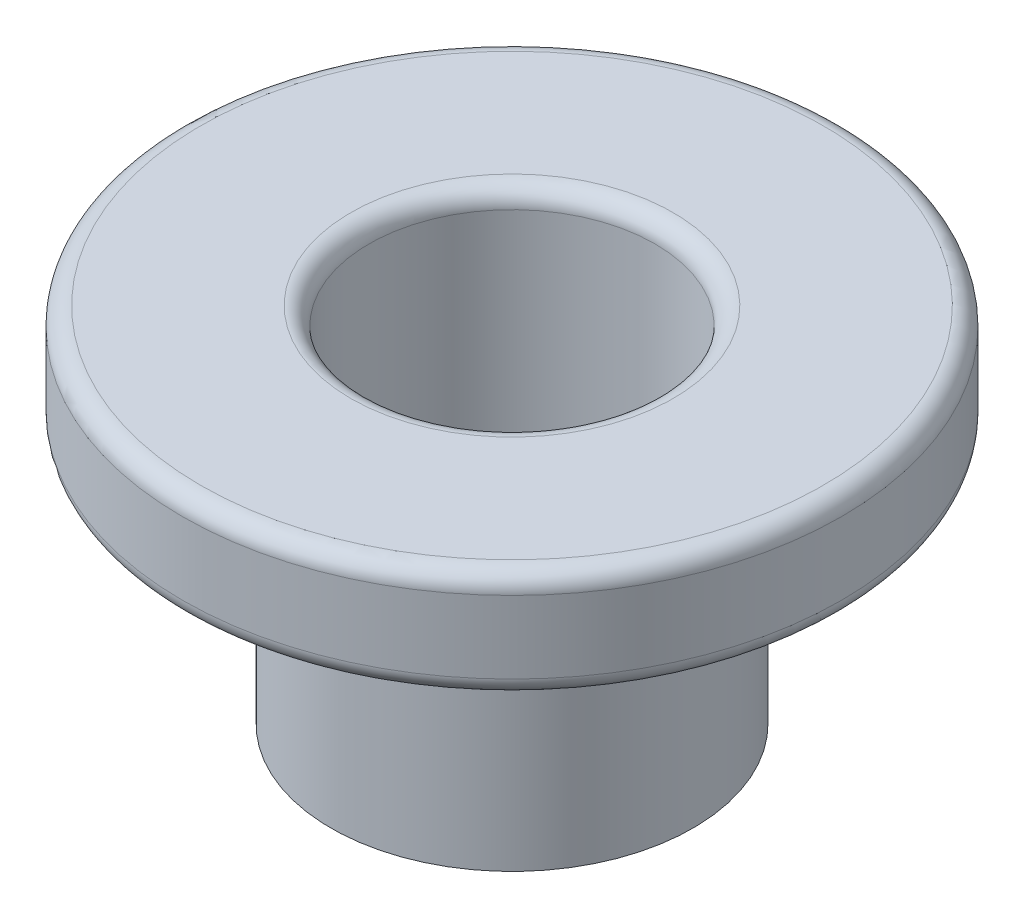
SolidWorks part; units mm, degrees
ref_plane "Front" through (0, 0, 0) normal (0, 0, 1) x (1, 0, 0)
ref_plane "Top" through (0, 0, 0) normal (0, 1, 0) x (1, 0, 0)
ref_plane "Right" through (0, 0, 0) normal (1, 0, 0) x (0, 0, -1)
sketch "Sketch1" plane through (0, 0, 0) normal (0, 0, 1) x (1, 0, 0)
  line L0 (2.0066, 0) -> (2.0066, 5.08)
  line L1 (2.0066, 5.08) -> (4.6228, 5.08)
  line L2 (4.6228, 5.08) -> (4.6228, 3.556)
  line L3 (4.6228, 3.556) -> (2.54, 3.556)
  line L4 (2.54, 3.556) -> (2.54, 0)
  line L5 (2.54, 0) -> (2.0066, 0)
  line L6 (0, 0) -> (0, 5.08) construction
  dimension "D1" = 2.54
  dimension "D2" = 2.0066
  dimension "D3" = 4.6228
  dimension "D4" = 1.524
  dimension "D5" = 5.08
revolve "Revolve1" add sketch "Sketch1" angle 360 about L6
fillet "Fillet1" radius 0.254 3 edges at (0, 3.556, -4.6228) (0, 5.08, -4.6228) (0, 5.08, -2.0066)
